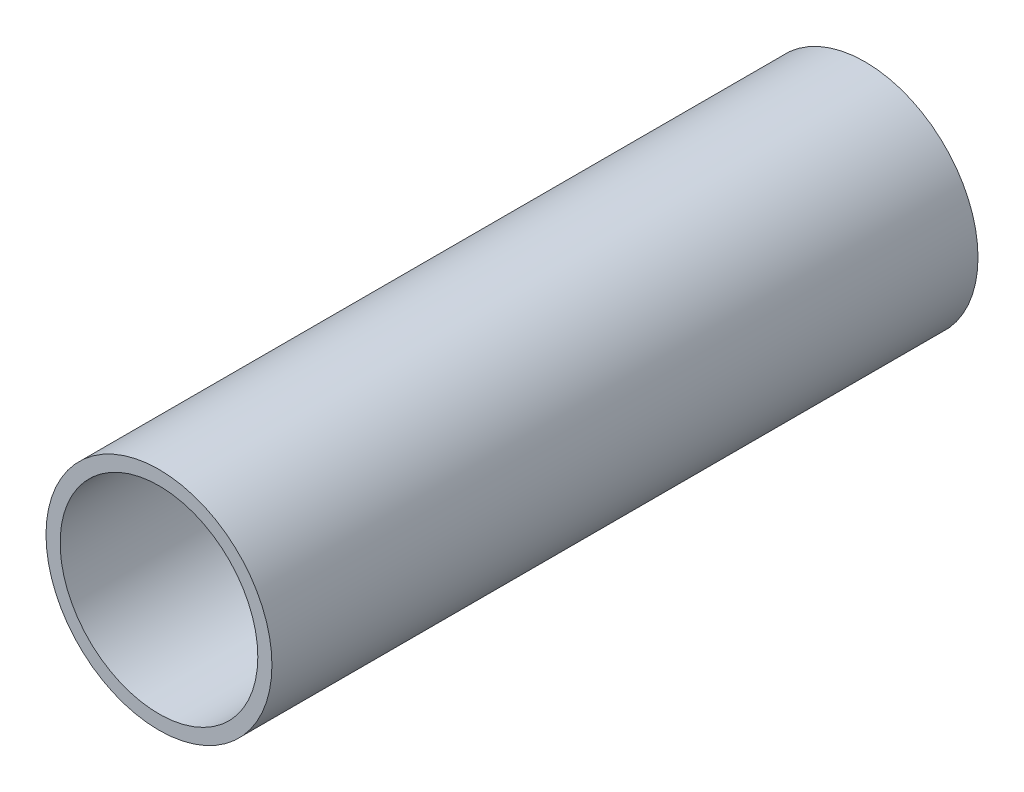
SolidWorks part; units mm, degrees
ref_plane "Plan de face" through (0, 0, 0) normal (0, 0, 1) x (1, 0, 0)
ref_plane "Plan de dessus" through (0, 0, 0) normal (0, 1, 0) x (1, 0, 0)
ref_plane "Plan de droite" through (0, 0, 0) normal (1, 0, 0) x (0, 0, -1)
sketch "Esquisse1" plane through (0, 0, 0) normal (0, 0, 1) x (1, 0, 0)
  circle A0 centre (0, 0) radius 16
  circle A1 centre (0, 0) radius 14
  dimension "D1" = 32
  dimension "D2" = 28
extrude "Boss.-Extru.1" add sketch "Esquisse1" along normal blind 100
